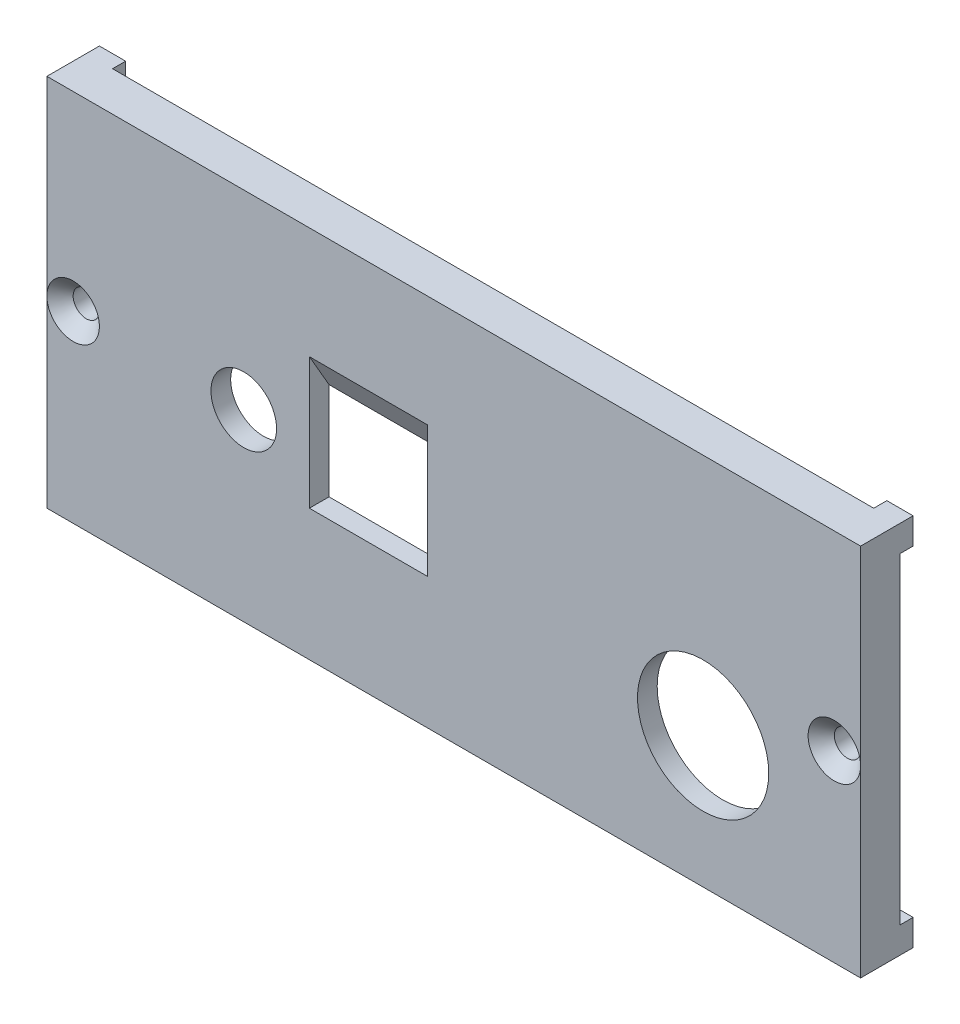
SolidWorks part; units mm, degrees
ref_plane "Front Plane" through (0, 0, 0) normal (0, 0, 1) x (1, 0, 0)
ref_plane "Top Plane" through (0, 0, 0) normal (0, 1, 0) x (1, 0, 0)
ref_plane "Right Plane" through (0, 0, 0) normal (1, 0, 0) x (0, 0, -1)
sketch "Sketch1" plane through (0, 0, 0) normal (0, 0, 1) x (1, 0, 0)
  line L0 (0, 52.4043) -> (0, -35.969) construction
  line L1 (-31, 0) -> (31, 0)
  line L2 (31, 0) -> (31, 28.5)
  line L3 (31, 28.5) -> (-31, 28.5)
  line L4 (-31, 0) -> (-31, 28.5)
  point P8 (0, 28.5)
  point P9 (0, 0)
extrude "Extrude1" add sketch "Sketch1" along normal blind 3
sketch "Sketch2" plane through (0, 0, 0) normal (0, 0, -1) x (-1, 0, 0)
  line L0 (0, 0) -> (0, 28.5) construction
  line L1 (-31, 28.5) -> (31, 28.5) construction
  line L2 (0, 0) -> (0, 2)
  line L3 (-27, 2) -> (27, 2)
  line L4 (27, 2) -> (27, 25.5)
  line L5 (27, 25.5) -> (-27, 25.5)
  line L6 (-27, 2) -> (-27, 25.5)
  point P11 (0, 25.5)
extrude "Cut-Extrude1" cut sketch "Sketch2" against normal blind 1.5
sketch "Sketch3" plane through (0, 0, 0) normal (0, 0, -1) x (-1, 0, 0)
  line L1 (-31, 28.5) -> (-29, 28.5)
  line L2 (-31, 28.5) -> (-31, 26.5)
  line L3 (-31, 26.5) -> (-29, 26.5)
  line L4 (-29, 28.5) -> (-29, 26.5)
  line L5 (-31, 0) -> (-29, 0)
  line L6 (-31, 0) -> (-31, 2)
  line L7 (-31, 2) -> (-29, 2)
  line L8 (-29, 0) -> (-29, 2)
  line L9 (31, 28.5) -> (29, 28.5)
  line L10 (31, 28.5) -> (31, 26.5)
  line L11 (31, 26.5) -> (29, 26.5)
  line L12 (29, 28.5) -> (29, 26.5)
  line L13 (31, 0) -> (29, 0)
  line L14 (31, 0) -> (31, 2)
  line L15 (31, 2) -> (29, 2)
  line L16 (29, 0) -> (29, 2)
extrude "Extrude2" add sketch "Sketch3" along normal blind 1
sketch "Sketch4" plane through (0, 0, 0) normal (0, 0, -1) x (-1, 0, 0)
  circle A0 centre (-29, 14) radius 1
  circle A1 centre (29, 14) radius 1
extrude "Cut-Extrude2" cut sketch "Sketch4" against normal through all
sketch "Sketch5" plane through (0, 0, 3) normal (0, 0, 1) x (1, 0, 0)
  line L1 (-11, 10) -> (-2, 10)
  line L2 (-11, 10) -> (-11, 16)
  line L3 (-11, 16) -> (-2, 16)
  line L4 (-2, 10) -> (-2, 16)
  circle A0 centre (-16, 14) radius 2.5
  circle A1 centre (19, 10) radius 5
  point P5 (-11, 10)
extrude "Cut-Extrude3" cut sketch "Sketch5" against normal through all
chamfer "Chamfer3" distance 4 angle 30 1 edges at (-6.5, 16, 3)
chamfer "Chamfer4" distance 1 angle 45 1 edges at (-30, 14, 3)
chamfer "Chamfer5" distance 1 angle 45 1 edges at (28, 14, 3)
